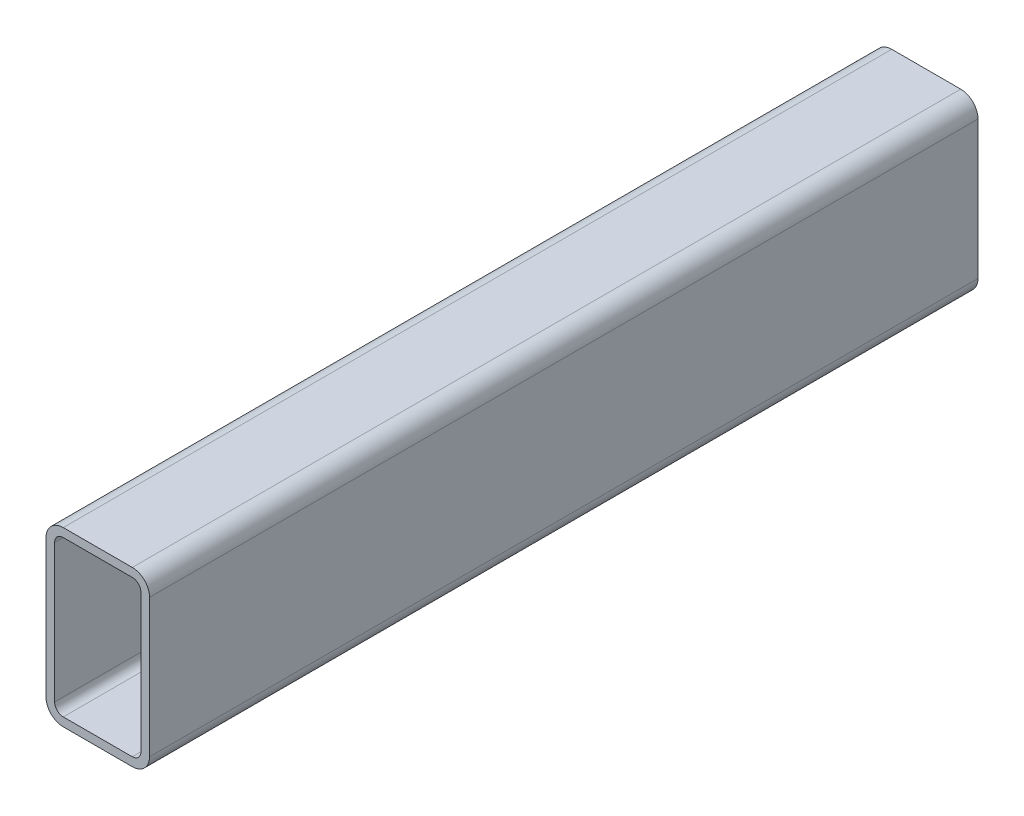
SolidWorks part; units mm, degrees
ref_plane "Front Plane" through (0, 0, 0) normal (0, 0, 1) x (1, 0, 0)
ref_plane "Top Plane" through (0, 0, 0) normal (0, 1, 0) x (1, 0, 0)
ref_plane "Right Plane" through (0, 0, 0) normal (1, 0, 0) x (0, 0, -1)
sketch "Sketch1" plane through (0, 0, 0) normal (0, 0, 1) x (1, 0, 0)
  line B0 (6.35, 63.5) -> (31.75, 63.5)
  arc B1 (38.1, 57.15) -> (31.75, 63.5) centre (31.75, 57.15) ccw
  line B2 (38.1, 57.15) -> (38.1, 6.35)
  arc B3 (31.75, 0) -> (38.1, 6.35) centre (31.75, 6.35) ccw
  line B4 (31.75, 0) -> (6.35, 0)
  arc B5 (0, 6.35) -> (6.35, 0) centre (6.35, 6.35) ccw
  line B6 (0, 6.35) -> (0, 57.15)
  arc B7 (6.35, 63.5) -> (0, 57.15) centre (6.35, 57.15) ccw
  line B8 (6.35, 60.325) -> (31.75, 60.325)
  arc B9 (34.925, 57.15) -> (31.75, 60.325) centre (31.75, 57.15) ccw
  line B10 (34.925, 57.15) -> (34.925, 6.35)
  arc B11 (31.75, 3.175) -> (34.925, 6.35) centre (31.75, 6.35) ccw
  line B12 (31.75, 3.175) -> (6.35, 3.175)
  arc B13 (3.175, 6.35) -> (6.35, 3.175) centre (6.35, 6.35) ccw
  line B14 (3.175, 6.35) -> (3.175, 57.15)
  arc B15 (6.35, 60.325) -> (3.175, 57.15) centre (6.35, 57.15) ccw
sketch_block_instance "HSS2.5x1.5x0.125-1"
sketch_block "HSS2.5x1.5x0.125"
extrude "Boss-Extrude1" add sketch "Sketch1" along normal blind 304.8
